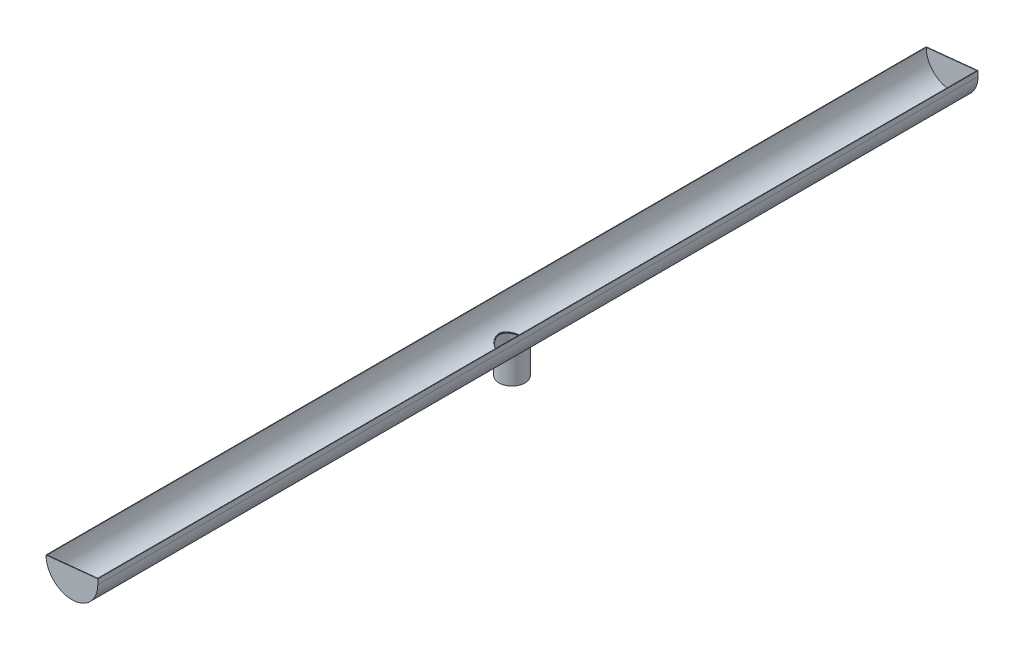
SolidWorks part; units mm, degrees
ref_plane "Plan de face" through (0, 0, 0) normal (0, 0, 1) x (1, 0, 0)
ref_plane "Plan de dessus" through (0, 0, 0) normal (0, 1, 0) x (1, 0, 0)
ref_plane "Plan de droite" through (0, 0, 0) normal (1, 0, 0) x (0, 0, -1)
sketch "Esquisse1" plane through (0, 0, 0) normal (0, 0, 1) x (1, 0, 0)
  line L0 (49, 0) -> (49, 10)
  line L1 (49, 10) -> (50, 10)
  line L2 (50, 10) -> (50, 0)
  line L3 (-50, 0) -> (-49, 0)
  arc A0 (-49, 0) -> (49, 0) centre (0, 0) ccw
  arc A1 (50, 0) -> (-50, 0) centre (0, 0) cw
  dimension "D1" = 10
  dimension "D2" = 1
extrude "Boss.-Extru.1" add sketch "Esquisse1" along normal mid plane 1700
sketch "Esquisse2" plane through (0, 0, 850) normal (0, 0, 1) x (1, 0, 0)
  line L0 (49, 10) -> (49, 0) construction
  line L1 (49, 0) -> (49, 10)
  line L2 (49, 10) -> (-49, 0)
  arc A0 (-49, 0) -> (49, 0) centre (0, 0) ccw
extrude "Boss.-Extru.2" add sketch "Esquisse2" against normal blind 1
pattern_linear "Répétition linéaire1" count 2 spacing 1699 along (0, 0, -1) of "Boss.-Extru.2"
sketch "Esquisse3" plane through (0, 0, 0) normal (0, 1, 0) x (1, 0, 0)
  circle A0 centre (0, 0) radius 25
extrude "Enlèv. mat.-Extru.1" cut sketch "Esquisse3" against normal through all
ref_plane "Plan1" through (0, -100, 0) normal (0, 1, 0) x (1, 0, 0)
sketch "Esquisse4" plane through (0, -100, 0) normal (0, 1, 0) x (1, 0, 0)
  circle A0 centre (0, 0) radius 25
  circle A1 centre (0, 0) radius 24
extrude "Boss.-Extru.5" add sketch "Esquisse4" along normal up to surface (50 mm away) separate body
sketch "Esquisse5" plane through (0, 0, 0) normal (1, 0, 0) x (0, 0, -1)
  line L0 (55, -100) -> (-55, -100) construction
  line L1 (-25.2454, -75) -> (-25.2454, -100)
  line L2 (-25.2454, -100) -> (25.2454, -100)
  line L3 (25.2454, -100) -> (25.2454, -75)
  circle A0 centre (0, -75) radius 25.2454
  circle A1 centre (0, -75) radius 24
  point P0 (0, -75)
  dimension "D1" = 25
